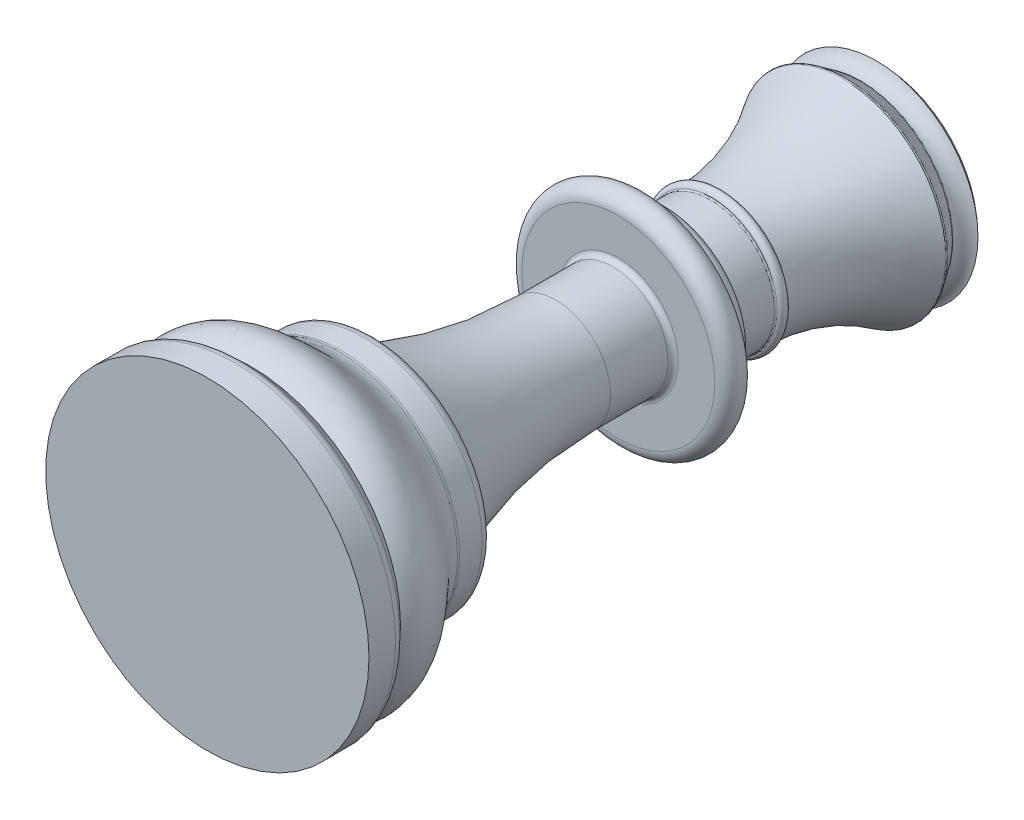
SolidWorks part; units mm, degrees
ref_plane "Front" through (0, 0, 0) normal (0, 0, 1) x (1, 0, 0)
ref_plane "Top" through (0, 0, 0) normal (0, 1, 0) x (1, 0, 0)
ref_plane "Right" through (0, 0, 0) normal (1, 0, 0) x (0, 0, -1)
sketch "Sketch1" plane through (0, 0, 0) normal (0, 1, 0) x (1, 0, 0)
  line L0 (-13.9464, 3.4466) -> (16.0536, 3.4466) construction
  line L1 (0, 0) -> (0, 66)
  line L2 (0, 0) -> (15.5, 0)
  line L3 (5.25, 39.4) -> (9.25, 39.4)
  line L4 (5.25, 39.4) -> (5.25, 33.4)
  line L5 (8.9955, 16.5) -> (11.3279, 15.75)
  line L6 (11.3279, 15.75) -> (11.3279, 12.75)
  line L7 (15.5, 0) -> (15.5, 2.9554)
  line L8 (11.3279, 12.75) -> (11.9027, 10.1078) construction
  line L9 (11.9027, 10.1078) -> (14.2626, 9.7302) construction
  line L10 (14.2626, 9.7302) -> (16.182, 6.8983) construction
  line L11 (16.182, 6.8983) -> (14.2941, 4.2237) construction
  line L12 (14.2941, 4.2237) -> (15.5, 2.9554)
  line L13 (8.1, 42.6) -> (9.652, 41.9363)
  line L14 (8.1, 42.6) -> (8.1, 44.1)
  line L15 (8.1, 44.1) -> (6.15, 44.1)
  line L16 (6.15, 44.1) -> (6.15, 48.35)
  line L17 (9.941, 61) -> (8.8025, 62.6278)
  line L19 (2.75, 63.25) -> (8.8025, 62.6278)
  arc A0 (5.25, 33.4) -> (8.9955, 16.5) centre (45.25, 33.4) ccw
  arc A1 (9.25, 39.4) -> (9.652, 41.9363) centre (9.25, 40.7) ccw
  arc A2 (6.15, 48.35) -> (6.15, 49.35) centre (6.15, 48.85) ccw
  arc A3 (6.15, 49.35) -> (9.941, 61) centre (27.1464, 48.9595) cw
  arc A4 (2.75, 63.25) -> (0, 66) centre (0, 63.25) ccw
  spline S0 degree 4 poles (11.3279, 12.75) (11.9027, 10.1078) (14.2626, 9.7302) (16.182, 6.8983) (14.2941, 4.2237) knots 0 0 0 0 0 1 1 1 1 1
  dimension "D6" = 40
  dimension "D16" = 1.3
  dimension "D17" = 0.5
  dimension "D20" = 21
  dimension "D23" = 2.75
  dimension "D1" = 30
  dimension "D2" = 66
  dimension "D3" = 5.25
  dimension "D4" = 4
  dimension "D5" = 39.4
  dimension "D7" = 6
  dimension "D8" = 16.5
  dimension "D9" = 15.75
  dimension "D10" = 3
  dimension "D11" = 2.45
  dimension "D12" = 15.5
  dimension "D13" = 6.15
  dimension "D14" = 1.95
  dimension "D15" = 1.5
  dimension "D18" = 4.25
  dimension "D19" = 2.75
  dimension "D21" = 5
  dimension "D22" = 16.65
  dimension "D24" = 1.688
  dimension "D25" = 2.75
revolve "Revolve1" add sketch "Sketch1" angle 360 about L1
fillet "Fillet1" radius 1 4 edges at (8.1, 0, -44.1) (15.5, 0, -2.9554) (11.3279, 0, -12.75) (11.3279, 0, -15.75)
sketch "Sketch2" plane through (0, 0, 0) normal (1, 0, 0) x (0, 0, -1)
  line L0 (70, 0) -> (60, -10) construction
  line L1 (60, -10) -> (60, 0) construction
  line L2 (60, 0) -> (70, 0) construction
  line L3 (60, 0) -> (65, -5)
  dimension "D1" = 45
  dimension "D2" = 60
  dimension "D3" = 10
ref_plane "Plane1" through (0, -5, -65) normal (0, -0.7071, -0.7071) x (-1, 0, 0)
sketch "Sketch3" plane through (0, -5, -65) normal (0, -0.7071, -0.7071) x (-1, 0, 0)
  line L0 (0, 7.0711) -> (0, -7.0711) construction
  line L1 (0, 0) -> (0, -6.3222)
  arc A0 (0, -6.3222) -> (0, 0) centre (-1.5025, -3.1611) ccw
  ellipse E0 centre (0, 0.7071) end of major axis (-9.941, 0.7071) minor radius 7.0293 construction
  point P3 (0, -6.3222)
  dimension "D1" = 3.5
ref_plane "Plane2" through (0, 0, -62.5) normal (0, 0, -1) x (-1, 0, 0)
sketch "Sketch6" plane through (0, 0, 0) normal (0, 1, 0) x (1, 0, 0)
  line L0 (9.759, 64.1278) -> (9.2, 64.6278)
  line L2 (8.8025, 62.6278) -> (2.75, 63.25) construction
  line L3 (9.941, 61) -> (8.8025, 62.6278) construction
  line L4 (9.941, 61) -> (8.8025, 62.6278) construction
  line L5 (8.8025, 62.6278) -> (2.75, 63.25) construction
  line L6 (0, 62.6278) -> (0, 68.7304) construction
  line L7 (8.8025, 62.6278) -> (-8.8025, 62.6278) construction
  line L8 (6.5, 62.8645) -> (8.8025, 62.6278)
  arc A0 (8.8025, 62.6278) -> (9.759, 64.1278) centre (10.2991, 62.7284) cw
  arc A1 (9.2, 64.6278) -> (6.5, 62.8645) centre (9.5486, 61.1452) ccw
  dimension "D4" = 1.5
  dimension "D5" = 3.5
  dimension "D1" = 1.5
  dimension "D2" = 2
  dimension "D3" = 0.75
  dimension "D6" = 9.2
  dimension "D7" = 6.5
revolve "Revolve2" add sketch "Sketch6" angle 360 about L6
ref_plane "Plane3" through (0, -7.1213, -67.1213) normal (0, -0.7071, -0.7071) x (-1, 0, 0)
fillet "Fillet3" radius 0.15 8 edges at (8.9955, 0, -16.5) (6.15, 0, -44.1) (6.15, 0, -48.35) (6.15, 0, -49.35) (9.941, 0, -61) (8.8025, 0, -62.6278) (2.75, 0, -63.25) (6.5, 0, -62.8645)
fillet "Fillet4" radius 0.5 1 edges at (5.25, 0, -39.4)
